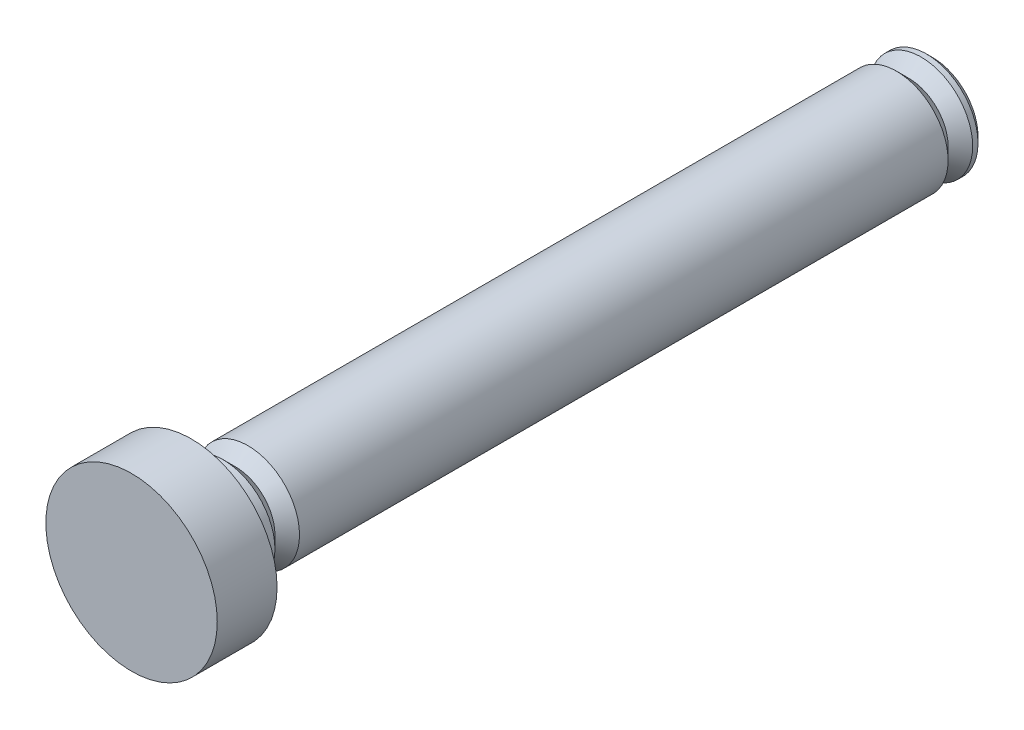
SolidWorks part; units mm, degrees
ref_plane "Front Plane" through (0, 0, 0) normal (0, 0, 1) x (1, 0, 0)
ref_plane "Top Plane" through (0, 0, 0) normal (0, 1, 0) x (1, 0, 0)
ref_plane "Right Plane" through (0, 0, 0) normal (1, 0, 0) x (0, 0, -1)
sketch "Sketch1" plane through (0, 0, 0) normal (1, 0, 0) x (0, 0, -1)
  line L0 (0, 0) -> (38.1, 0)
  line L1 (0, 0) -> (0, 4.0767)
  line L2 (0, 4.0767) -> (2.8448, 4.0767)
  line L3 (2.8448, 4.0767) -> (2.8448, 2.4511)
  line L4 (2.8448, 2.4511) -> (4.3688, 2.4511)
  line L5 (4.3688, 2.4511) -> (4.953, 1.8669)
  line L6 (4.953, 1.8669) -> (5.5372, 2.4511)
  line L7 (5.5372, 2.4511) -> (36.3855, 2.4511)
  line L8 (36.3855, 2.4511) -> (36.9697, 1.8669)
  line L9 (36.9697, 1.8669) -> (37.5539, 2.4511)
  line L10 (37.5539, 2.4511) -> (37.8079, 2.4511)
  line L11 (37.8079, 2.4511) -> (38.1, 2.159)
  line L12 (38.1, 2.159) -> (38.1, 0)
  dimension "D1" = 38.1
  dimension "D2" = 4.0767
  dimension "D3" = 2.8448
  dimension "D4" = 2.4511
  dimension "D5" = 1.524
  dimension "D6" = 135
  dimension "D7" = 1.8669
  dimension "D8" = 1.8669
  dimension "D9" = 0.254
  dimension "D10" = 2.159
revolve "Revolve1" add sketch "Sketch1" angle 360 about L0
